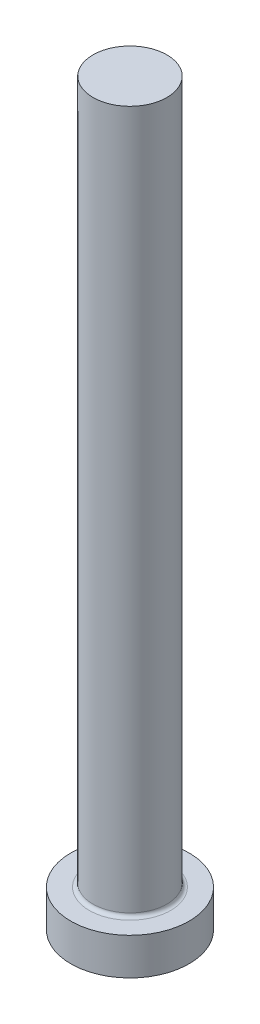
SolidWorks part; units mm, degrees
ref_plane "Plano frontal" through (0, 0, 0) normal (0, 0, 1) x (1, 0, 0)
ref_plane "Plano superior" through (0, 0, 0) normal (0, 1, 0) x (1, 0, 0)
ref_plane "Plano direito" through (0, 0, 0) normal (1, 0, 0) x (0, 0, -1)
sketch "Esboço1" plane through (0, 0, 0) normal (0, 0, 1) x (1, 0, 0)
  line L0 (0, 0) -> (8, 0)
  line L1 (8, 0) -> (8, 5)
  line L2 (8, 5) -> (5.5, 5)
  line L3 (5, 5.5) -> (5, 100)
  line L4 (5, 100) -> (0, 100)
  line L5 (0, 100) -> (0, 0) construction
  line L6 (0, 0) -> (0, 100)
  arc A0 (5.5, 5) -> (5, 5.5) centre (5.5, 5.5) cw
  dimension "D3" = 0.5
  dimension "D1" = 16
  dimension "D2" = 10
  dimension "D4" = 5
  dimension "D5" = 100
revolve "Revolução1" add sketch "Esboço1" angle 360 about L5
sketch "Esboço2"
  dimension "D1" = 0.9
  dimension "D2" = 1.4
  dimension "D3" = 4.3
  dimension "D4" = 0.6
wrap "Envolver1" sketch "Esboço2" wrap type deboss source sketch "Esboço2" thickness 0.1 parameters "D1"=0.1
